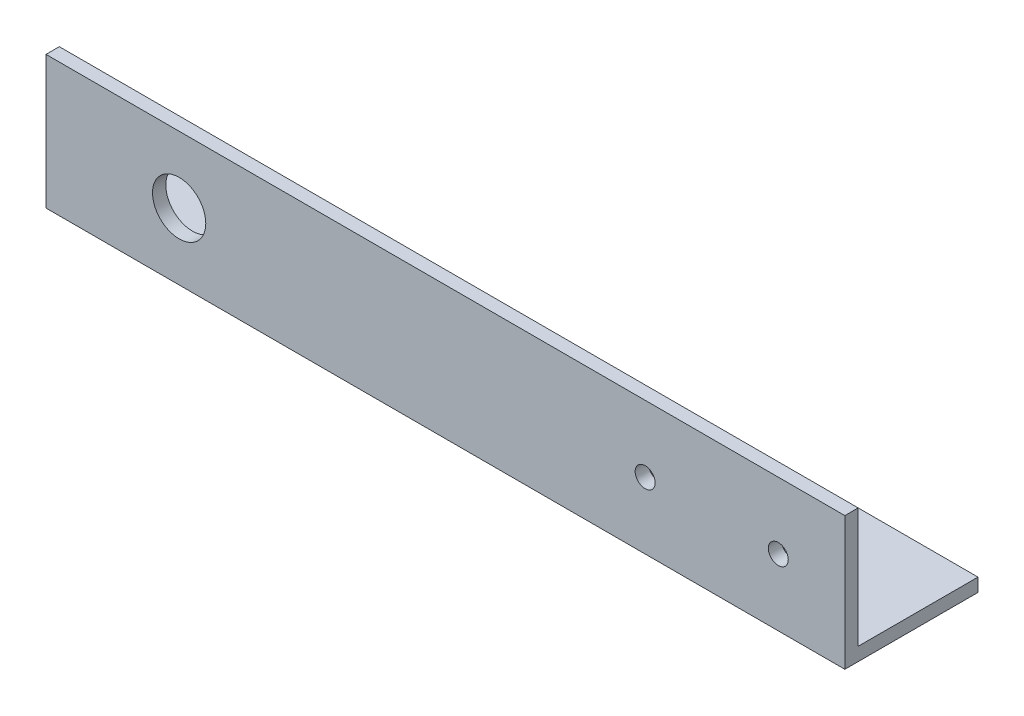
SolidWorks part; units mm, degrees
ref_plane "正面" through (0, 0, 0) normal (0, 0, 1) x (1, 0, 0)
ref_plane "平面" through (0, 0, 0) normal (0, 1, 0) x (1, 0, 0)
ref_plane "右側面" through (0, 0, 0) normal (1, 0, 0) x (0, 0, -1)
sketch "ｽｹｯﾁ1" plane through (0, 0, 0) normal (1, 0, 0) x (0, 0, -1)
  line L0 (0, 0) -> (0, 20)
  line L1 (0, 20) -> (2, 20)
  line L2 (2, 2) -> (20, 2)
  line L3 (20, 2) -> (20, 0)
  line L4 (20, 0) -> (0, 0)
  line L5 (2, 20) -> (2, 2)
  dimension "D1" = 20
  dimension "D2" = 20
  dimension "D3" = 2
  dimension "D4" = 2
extrude "押し出し1" add sketch "ｽｹｯﾁ1" along normal blind 120
sketch "ｽｹｯﾁ2" plane through (0, 0, 0) normal (0, 0, 1) x (1, 0, 0)
  line L0 (0, 10) -> (20, 10) construction
  line L1 (0, 20) -> (0, 0) construction
  circle A0 centre (20, 10) radius 4
  dimension "D2" = 8
  dimension "D1" = 20
extrude "押し出し2" cut sketch "ｽｹｯﾁ2" against normal through all
sketch "ｽｹｯﾁ3" plane through (0, 0, 0) normal (0, 0, 1) x (1, 0, 0)
  line L0 (120, 10) -> (90, 10) construction
  line L1 (120, 20) -> (120, 0) construction
  circle A0 centre (90, 10) radius 1.5
  dimension "D2" = 3
  dimension "D1" = 30
extrude "押し出し3" cut sketch "ｽｹｯﾁ3" against normal through all
sketch "ｽｹｯﾁ4" plane through (0, 0, 0) normal (0, 0, 1) x (1, 0, 0)
  line L0 (120, 10) -> (110, 10) construction
  line L1 (120, 20) -> (120, 0) construction
  circle A0 centre (110, 10) radius 1.5
  dimension "D2" = 3
  dimension "D1" = 10
extrude "押し出し4" cut sketch "ｽｹｯﾁ4" against normal through all
